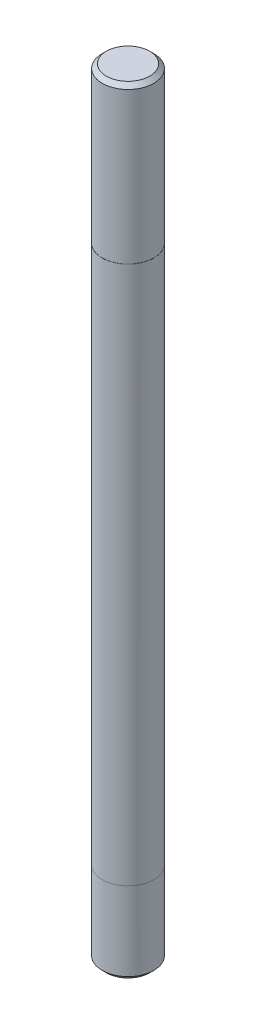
SolidWorks part; units mm, degrees
ref_plane "Front" through (0, 0, 0) normal (0, 0, 1) x (1, 0, 0)
ref_plane "Top" through (0, 0, 0) normal (0, 1, 0) x (1, 0, 0)
ref_plane "Right" through (0, 0, 0) normal (1, 0, 0) x (0, 0, -1)
sketch "Sketch1" plane through (0, 0, 0) normal (0, 1, 0) x (1, 0, 0)
  circle A0 centre (0, 0) radius 2.5
extrude "Extrude1" add sketch "Sketch1" along normal blind 75
sketch "Sketch2" plane through (0, 75, 0) normal (0, 1, 0) x (-1, 0, 0)
  circle A0 centre (0, 0) radius 2.5
  circle A1 centre (0, 0) radius 2.49
extrude "Cut-Extrude1" cut sketch "Sketch2" against normal blind 15
sketch "Sketch3" plane through (0, 0, 0) normal (0, -1, 0) x (1, 0, 0)
  circle A0 centre (0, 0) radius 2.5
  circle A1 centre (0, 0) radius 2.49
extrude "Cut-Extrude2" cut sketch "Sketch3" against normal blind 8
chamfer "Chamfer1" distance 0.4 angle 45 2 edges at (0, 0, -2.49) (0, 75, 2.49)
